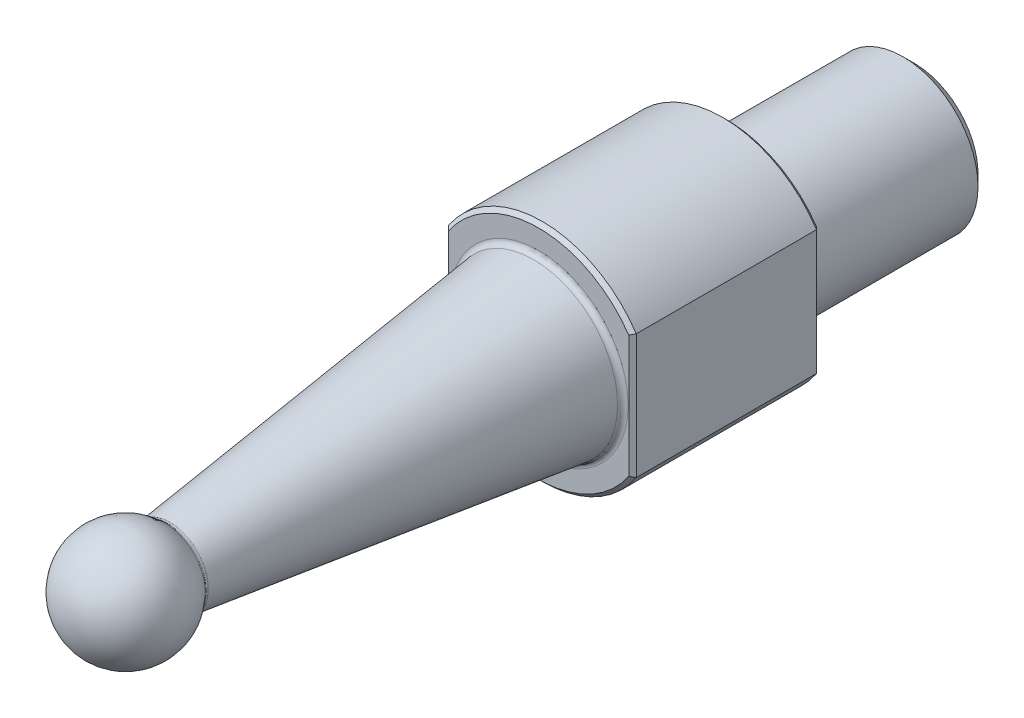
SolidWorks part; units mm, degrees
ref_plane "Plan de face" through (0, 0, 0) normal (0, 0, 1) x (1, 0, 0)
ref_plane "Plan de dessus" through (0, 0, 0) normal (0, 1, 0) x (1, 0, 0)
ref_plane "Plan de droite" through (0, 0, 0) normal (1, 0, 0) x (0, 0, -1)
imported_body " Importée1"
ref_plane "Plan1" through (0, 0, 5) normal (0, 0, 1) x (1, 0, 0)
sketch "Esquisse1" plane through (0, 0, 5) normal (0, 0, 1) x (1, 0, 0)
  line L0 (532.3572, -137.7074) -> (532.3572, -134.3908)
  line L1 (527.3572, -134.3908) -> (527.3572, -137.7074)
  arc A0 (532.3572, -134.3908) -> (527.3572, -134.3908) centre (529.8572, -136.0491) ccw
  arc A1 (527.3572, -137.7074) -> (532.3572, -137.7074) centre (529.8572, -136.0491) ccw
extrude "Extrusion1" add sketch "Esquisse1" against normal blind 5
sketch "Esquisse2" plane through (0, 0, 0) normal (0, 0, -1) x (-1, 0, 0)
  circle A0 centre (-529.8572, -136.0491) radius 2
extrude "Extrusion2" add sketch "Esquisse2" along normal blind 5
chamfer "Chanfrein1" distance 0.3 angle 45 1 edges at (527.8572, -136.0491, -5)
chamfer "Chanfrein2" distance 0.1 angle 45 8 edges at (527.3572, -136.0491, 0) (529.8572, -139.0491, 0) (532.3572, -136.0491, 0) (529.8572, -133.0491, 0) (532.3572, -136.0491, 5) (529.8572, -133.0491, 5) (527.3572, -136.0491, 5) (529.8572, -139.0491, 5)
fillet "Congé1" radius 0.15 2 edges at (528.8439, -136.0491, 14.894) (532.1072, -136.0491, 5)
